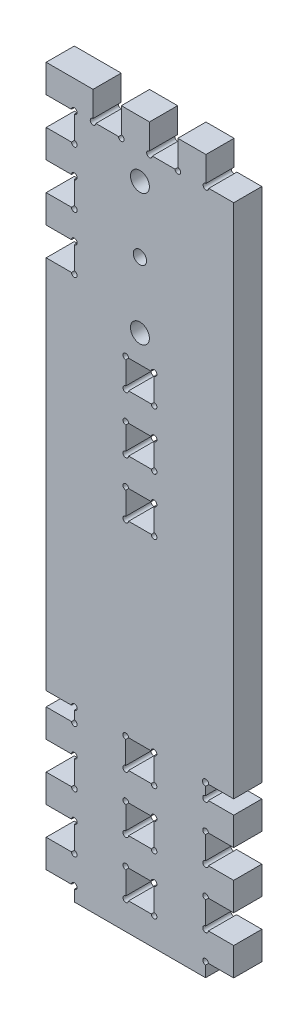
SolidWorks part; units mm, degrees
ref_plane "Ebene vorne" through (0, 0, 0) normal (0, 0, 1) x (1, 0, 0)
ref_plane "Ebene oben" through (0, 0, 0) normal (0, 1, 0) x (1, 0, 0)
ref_plane "Ebene rechts" through (0, 0, 0) normal (1, 0, 0) x (0, 0, -1)
sketch "Skizze1" plane through (0, 0, 0) normal (0, 0, 1) x (1, 0, 0)
  line L0 (0, 82.6) -> (13.5, 82.6)
  line L1 (0, 365.2705) -> (13.5, 365.2705)
  line L2 (15, 84.1) -> (15, 88.6)
  line L5 (0, 82.6) -> (0, 67.6)
  line L6 (0, 67.6) -> (13.5, 67.6)
  line L7 (15, 66.1) -> (15, 54)
  line L8 (13.5, 52.5) -> (0, 52.5)
  line L9 (0, 52.5) -> (0, 37.5)
  line L10 (0, 37.5) -> (13.5, 37.5)
  line L11 (15, 36) -> (15, 23.9)
  line L12 (85, 88.4) -> (85, 84.1)
  line L13 (0, 22.4) -> (0, 7.4)
  line L14 (13.5, 22.4) -> (0, 22.4)
  line L15 (0, 7.4) -> (13.5, 7.4)
  line L16 (86.7, 90.1) -> (100, 90.1)
  line L17 (86.5, 82.6) -> (100, 82.6)
  line L18 (100, 67.6) -> (86.5, 67.6)
  line L19 (85, 66.1) -> (85, 54)
  line L20 (86.5, 52.5) -> (100, 52.5)
  line L21 (100, 52.5) -> (100, 37.5)
  line L22 (100, 37.5) -> (86.5, 37.5)
  line L23 (85, 36) -> (85, 23.9)
  line L24 (100, 82.6) -> (100, 67.6)
  line L25 (86.5, 22.4) -> (100, 22.4)
  line L26 (100, 7.4) -> (86.5, 7.4)
  line L27 (100, 22.4) -> (100, 7.4)
  line L29 (15, 5.9) -> (15, 0)
  line L30 (85, 5.9) -> (85, 0)
  line L31 (85, 0) -> (15, 0)
  line L32 (0, 289.9705) -> (0, 90.1)
  line L33 (0, 90.1) -> (13.5, 90.1)
  line L34 (100, 90.1) -> (100, 365.4)
  line L35 (15, 291.4705) -> (15, 303.5705)
  line L36 (13.5, 350.1705) -> (0, 350.1705)
  line L37 (0, 305.0705) -> (0, 320.0705)
  line L39 (15, 321.5705) -> (15, 333.6705)
  line L40 (0, 335.1705) -> (13.5, 335.1705)
  line L41 (0, 335.1705) -> (0, 350.1705)
  line L42 (13.5, 320.0705) -> (0, 320.0705)
  line L43 (15, 351.6705) -> (15, 363.7705)
  line L44 (0, 305.0705) -> (13.5, 305.0705)
  line L45 (0, 365.2705) -> (0, 380.2705)
  line L46 (0, 380.2705) -> (25, 380.2705)
  line L47 (26.5, 365.2705) -> (38.6, 365.2705)
  line L48 (40.1, 366.7705) -> (40.1, 380.2705)
  line L49 (55.1, 380.2705) -> (54.9689, 366.7648)
  line L50 (40.1, 380.2705) -> (55.1, 380.2705)
  line L51 (56.6, 365.2705) -> (68.7, 365.2705)
  line L52 (70.2, 366.7705) -> (70.2, 380.2705)
  line L53 (85.2, 380.2705) -> (85.2, 366.9)
  line L54 (70.2, 380.2705) -> (85.2, 380.2705)
  line L55 (86.7, 365.4) -> (100, 365.4)
  line L56 (25, 366.7705) -> (25, 380.2705)
  line L57 (13.5, 289.9705) -> (0, 289.9705)
  arc A0 (13.5, 82.6) -> (15, 84.1) centre (15, 82.6) ccw
  arc A1 (13.5, 67.6) -> (15, 66.1) centre (15, 67.6) cw
  arc A2 (15, 54) -> (13.5, 52.5) centre (15, 52.5) cw
  arc A3 (13.5, 37.5) -> (15, 36) centre (15, 37.5) cw
  arc A4 (15, 23.9) -> (13.5, 22.4) centre (15, 22.4) cw
  arc A5 (13.5, 7.4) -> (15, 5.9) centre (15, 7.4) cw
  arc A6 (85, 84.1) -> (86.5, 82.6) centre (85, 82.6) ccw
  arc A7 (86.5, 67.6) -> (85, 66.1) centre (85, 67.6) ccw
  arc A8 (85, 54) -> (86.5, 52.5) centre (85, 52.5) ccw
  arc A9 (86.5, 37.5) -> (85, 36) centre (85, 37.5) ccw
  arc A10 (85, 23.9) -> (86.5, 22.4) centre (85, 22.4) ccw
  arc A11 (86.5, 7.4) -> (85, 5.9) centre (85, 7.4) ccw
  arc A12 (13.5, 289.9705) -> (15, 291.4705) centre (15, 289.9705) ccw
  arc A13 (13.5, 305.0705) -> (15, 303.5705) centre (15, 305.0705) cw
  arc A14 (13.5, 320.0705) -> (15, 321.5705) centre (15, 320.0705) ccw
  arc A15 (15, 333.6705) -> (13.5, 335.1705) centre (15, 335.1705) ccw
  arc A16 (13.5, 350.1705) -> (15, 351.6705) centre (15, 350.1705) ccw
  arc A17 (15, 363.7705) -> (13.5, 365.2705) centre (15, 365.2705) ccw
  arc A18 (25, 366.7705) -> (26.5, 365.2705) centre (25, 365.2705) ccw
  arc A19 (38.6, 365.2705) -> (40.1, 366.7705) centre (40.1, 365.2705) ccw
  arc A20 (54.9689, 366.7648) -> (56.6, 365.2705) centre (55.1, 365.2705) ccw
  arc A21 (68.7, 365.2705) -> (70.2, 366.7705) centre (70.2, 365.2705) ccw
  arc A22 (85.2, 366.9) -> (86.7, 365.4) centre (85.2, 365.4) ccw
  arc A23 (13.5, 90.1) -> (15, 88.6) centre (15, 90.1) cw
  arc A24 (86.7, 90.1) -> (85, 88.4) centre (85, 90.1) ccw
  dimension "D13" = 15
  dimension "D14" = 100
  dimension "D15" = 7.5
  dimension "D16" = 6
  dimension "D17" = 290.1705
  dimension "D18" = 14.8
  dimension "D12" = 1.5
  dimension "D19" = 1.5
  dimension "D20" = 1.5
  dimension "D21" = 1.5
  dimension "D22" = 1.5
  dimension "D23" = 1.5
  dimension "D36" = 1.5
  dimension "D37" = 1.5
  dimension "D38" = 1.5
  dimension "D39" = 1.5
  dimension "D40" = 1.5
  dimension "D41" = 1.5
  dimension "D42" = 1.5
  dimension "D43" = 1.5
  dimension "D44" = 1.5
  dimension "D45" = 1.5
  dimension "D46" = 1.5
  dimension "D3" = 15
  dimension "D5" = 15
  dimension "D6" = 15
  dimension "D7" = 15.1
  dimension "D8" = 15.1
  dimension "D9" = 15
  dimension "D10" = 15
  dimension "D11" = 15
  dimension "D24" = 15.1
  dimension "D25" = 15.1
  dimension "D28" = 15.1
  dimension "D29" = 15
  dimension "D30" = 15.1
  dimension "D31" = 15
  dimension "D32" = 15.1
  dimension "D33" = 100
  dimension "D34" = 10
  dimension "D35" = 15
  dimension "D47" = 15
  dimension "D48" = 15
  dimension "D49" = 15
  dimension "D51" = 13.5
  dimension "D52" = 15
  dimension "D53" = 12.1
  dimension "D54" = 13.5
  dimension "D55" = 12.1
  dimension "D56" = 13.5
  dimension "D57" = 15
  dimension "D58" = 15
  dimension "D59" = 5.9
  dimension "D60" = 15.1
  dimension "D61" = 15.1
  dimension "D62" = 7.4
extrude "Aufsatz-Linear austragen1" add sketch "Skizze1" along normal blind 15
sketch "Skizze3" plane through (0, 0, 0) normal (0, 0, -1) x (-1, 0, 0)
  line L0 (-100, 90.1) -> (-100, 365.4) construction
  line L1 (-56.6, 365.2705) -> (-68.7, 365.2705) construction
  circle A0 centre (-50, 315.2705) radius 3.55
  dimension "D1" = 50
  dimension "D2" = 7.1
  dimension "D3" = 50
extrude "Schnitt-Linear austragen3" cut sketch "Skizze3" against normal blind 17.5
sketch "Skizze5" plane through (0, 0, 15) normal (0, 0, 1) x (1, 0, 0)
  line L0 (15, 5.9) -> (15, 0) construction
  line L1 (85, 5.9) -> (85, 0) construction
  line L2 (43.95, 15) -> (56.05, 15)
  line L3 (57.55, 16.5) -> (57.55, 28.6)
  line L4 (0, 22.4) -> (0, 7.4) construction
  line L5 (85, 0) -> (15, 0) construction
  line L6 (42.45, 0) -> (42.45, 12.1) construction
  line L7 (57.55, 0) -> (57.55, 12.1) construction
  line L8 (42.45, 28.6) -> (42.45, 16.5)
  line L9 (43.95, 30.1) -> (56.05, 30.1)
  line L10 (15, 0) -> (85, 0) construction
  line L11 (57.5561, 46.6) -> (57.5561, 58.7)
  line L12 (42.4561, 58.7) -> (42.4561, 46.6)
  line L13 (43.9561, 60.2) -> (56.0561, 60.2)
  line L14 (43.9561, 45.1) -> (56.0561, 45.1)
  line L15 (57.5078, 76.7) -> (57.5078, 88.8)
  line L16 (43.9078, 75.2) -> (56.0078, 75.2)
  line L17 (43.9078, 90.3) -> (56.0078, 90.3)
  line L18 (42.4078, 88.8) -> (42.4078, 76.7)
  line L19 (43.95, 220.4) -> (56.05, 220.4)
  line L20 (42.45, 264.1) -> (42.45, 252)
  line L21 (57.55, 191.8) -> (57.55, 203.9061)
  line L22 (57.55, 252) -> (57.55, 264.1)
  line L23 (42.45, 234) -> (42.45, 221.9)
  line L24 (42.45, 203.9) -> (42.45, 191.8)
  line L25 (43.95, 190.3) -> (56.05, 190.3)
  line L26 (43.95, 250.5) -> (56.05, 250.5)
  line L27 (43.95, 235.5) -> (56.0983, 235.5)
  line L28 (57.55, 221.9) -> (57.55, 233.9532)
  line L29 (43.95, 205.4) -> (56.0439, 205.4)
  line L30 (43.95, 265.6) -> (56.05, 265.6)
  arc A0 (43.95, 15) -> (42.45, 16.5) centre (42.45, 15) cw
  arc A1 (56.05, 15) -> (57.55, 16.5) centre (57.55, 15) ccw
  arc A2 (42.45, 28.6) -> (43.95, 30.1) centre (42.45, 30.1) cw
  arc A3 (56.05, 30.1) -> (57.55, 28.6) centre (57.55, 30.1) cw
  arc A4 (56.0561, 60.2) -> (57.5561, 58.7) centre (57.5561, 60.2) cw
  arc A5 (42.4561, 58.7) -> (43.9561, 60.2) centre (42.4561, 60.2) cw
  arc A6 (56.0561, 45.1) -> (57.5561, 46.6) centre (57.5561, 45.1) ccw
  arc A7 (43.9561, 45.1) -> (42.4561, 46.6) centre (42.4561, 45.1) cw
  arc A8 (56.0078, 90.3) -> (57.5078, 88.8) centre (57.5078, 90.3) cw
  arc A9 (43.9078, 75.2) -> (42.4078, 76.7) centre (42.4078, 75.2) cw
  arc A10 (56.0078, 75.2) -> (57.5078, 76.7) centre (57.5078, 75.2) ccw
  arc A11 (42.4078, 88.8) -> (43.9078, 90.3) centre (42.4078, 90.3) cw
  arc A12 (42.45, 234) -> (43.95, 235.5) centre (42.45, 235.5) cw
  arc A13 (42.45, 203.9) -> (43.95, 205.4) centre (42.45, 205.4) cw
  arc A14 (43.95, 250.5) -> (42.45, 252) centre (42.45, 250.5) cw
  arc A15 (56.05, 220.4) -> (57.55, 221.9) centre (57.55, 220.4) ccw
  arc A16 (56.0439, 205.4) -> (57.55, 203.9061) centre (57.5439, 205.4061) cw
  arc A17 (56.05, 250.5) -> (57.55, 252) centre (57.55, 250.5) ccw
  arc A18 (43.95, 190.3) -> (42.45, 191.8) centre (42.45, 190.3) cw
  arc A19 (43.95, 220.4) -> (42.45, 221.9) centre (42.45, 220.4) cw
  arc A20 (56.0983, 235.5) -> (57.55, 233.9532) centre (57.5976, 235.4524) cw
  arc A21 (42.45, 264.1) -> (43.95, 265.6) centre (42.45, 265.6) cw
  arc A22 (56.05, 190.3) -> (57.55, 191.8) centre (57.55, 190.3) ccw
  arc A23 (56.05, 265.6) -> (57.55, 264.1) centre (57.55, 265.6) cw
  dimension "D1" = 27.45
  dimension "D2" = 27.45
  dimension "D3" = 1.5
  dimension "D4" = 1.5
  dimension "D9" = 2.1213
  dimension "D10" = 2.1213
  dimension "D11" = 1.5
  dimension "D7" = 15.1
  dimension "D19" = 1.5
  dimension "D20" = 2.1213
  dimension "D14" = 1.5
  dimension "D16" = 1.5
  dimension "D17" = 1.5
  dimension "D22" = 1.5
  dimension "D24" = 1.5
  dimension "D29" = 1.5
  dimension "D30" = 1.5
  dimension "D35" = 1.5
  dimension "D37" = 1.5
  dimension "D41" = 1.5
  dimension "D46" = 1.5
  dimension "D50" = 1.5
  dimension "D55" = 1.5
  dimension "D60" = 1.5
  dimension "D65" = 1.5
  dimension "D5" = 15
  dimension "D6" = 1.5
  dimension "D8" = 1.5
  dimension "D12" = 15.1
  dimension "D13" = 2.1213
  dimension "D15" = 2.1213
  dimension "D18" = 1.5
  dimension "D21" = 2.1213
  dimension "D23" = 2.1213
  dimension "D25" = 2.1213
  dimension "D26" = 15.1
  dimension "D27" = 15
  dimension "D28" = 0.0122
  dimension "D31" = 1.5
  dimension "D32" = 1.5
  dimension "D33" = 2.1213
  dimension "D34" = 2.1213
  dimension "D36" = 2.1213
  dimension "D38" = 2.1213
  dimension "D39" = 15.1
  dimension "D40" = 15
  dimension "D42" = 1.5
  dimension "D43" = 1.5
  dimension "D44" = 2.1213
  dimension "D45" = 2.1213
  dimension "D47" = 2.1213
  dimension "D48" = 2.1213
  dimension "D49" = 15.1
  dimension "D51" = 1.5
  dimension "D52" = 1.5
  dimension "D53" = 2.1213
  dimension "D54" = 2.1213
  dimension "D56" = 2.1213
  dimension "D57" = 2.1213
  dimension "D58" = 15.1
  dimension "D59" = 15
  dimension "D61" = 1.5
  dimension "D62" = 1.5
  dimension "D63" = 2.1213
  dimension "D64" = 2.1213
  dimension "D66" = 2.1213
  dimension "D67" = 2.1213
  dimension "D68" = 15.1
  dimension "D69" = 15
  dimension "D71" = 100
extrude "Schnitt-Linear austragen5" cut sketch "Skizze5" against normal blind 17.5 contours A23 L30 A21 L20 A14 L26 A17 L22 | A20 L27 A12 L23 A19 L19 A15 L28 | L25 A22 L21 A16 L29 A13 L24 A18 | A11 L18 A9 L16 A10 L15 A8 L17 | A7 L14 A6 L11 A4 L13 A5 L12 | A3 L9 A2 L8 A0 L2 A1 L3
sketch "Skizze6" plane through (0, 0, 15) normal (0, 0, 1) x (1, 0, 0)
  line L0 (38.6, 365.2705) -> (26.5, 365.2705) construction
  circle A0 centre (50, 350.2705) radius 5.05
  circle A1 centre (50, 280.2705) radius 5.05
  dimension "D1" = 10.1
  dimension "D2" = 10.1
  dimension "D3" = 85
  dimension "D4" = 70
extrude "Schnitt-Linear austragen6" cut sketch "Skizze6" against normal blind 7.5
